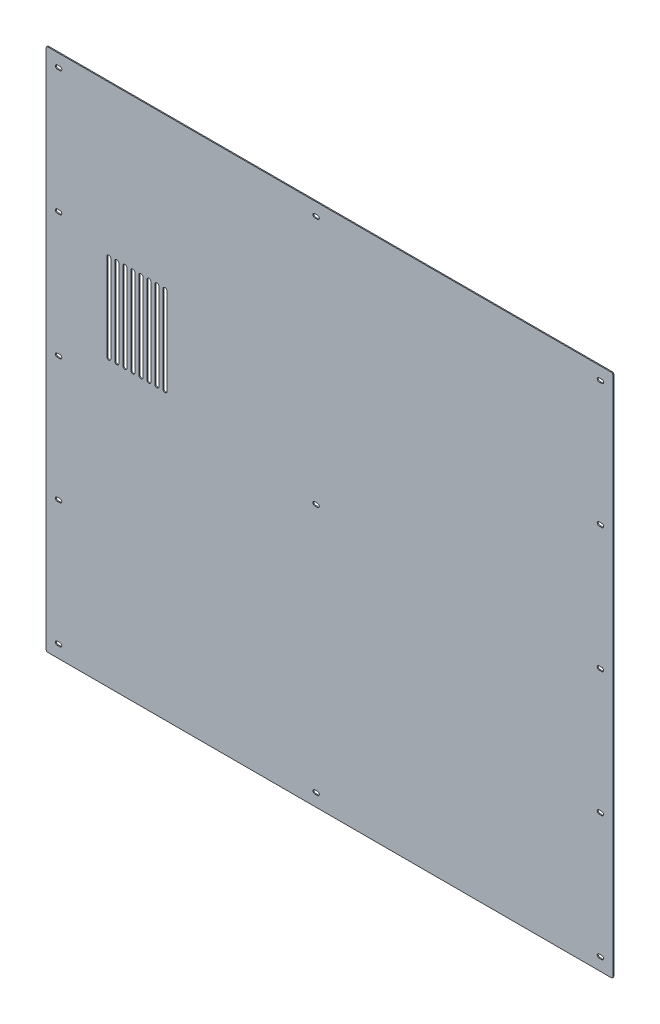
SolidWorks part; units mm, degrees
ref_plane "Ebene vorne" through (0, 0, 0) normal (0, 0, 1) x (1, 0, 0)
ref_plane "Ebene oben" through (0, 0, 0) normal (0, 1, 0) x (1, 0, 0)
ref_plane "Ebene rechts" through (0, 0, 0) normal (1, 0, 0) x (0, 0, -1)
sketch "Skizze1" plane through (0, 0, 0) normal (0, 0, 1) x (1, 0, 0)
  line L1 (-423.5, -392) -> (423.5, -392)
  line L2 (-423.5, -392) -> (-423.5, 392)
  line L3 (-423.5, 392) -> (423.5, 392)
  line L4 (423.5, -392) -> (423.5, 392)
  line L5 (-423.5, -392) -> (423.5, 392) construction
  line L6 (-423.5, 392) -> (423.5, -392) construction
  point P0 (0, 0)
  dimension "D1" = 847
  dimension "D2" = 784
base flange "Basis-Blech1" sketch "Skizze1" thickness 1.5 reverse thickness direction no parameters "D1"=8
hole_wizard "Durchgangsloch für M51" positions "Skizze7" profile "Skizze8" hole size "M5" standard "DIN"
sketch "Skizze7" plane through (0, 0, 0) normal (0, 0, 1) x (1, 0, 0)
  line L9 (-674.6731, 0) -> (0, 0) construction
  line L18 (0, 0) -> (0, 771.1759) construction
  line L20 (-405, -373) -> (-405, -186.5) construction
  line L21 (-405, -186.5) -> (-405, 0) construction
  line L22 (-405, 0) -> (-405, 186.5) construction
  line L23 (-405, 186.5) -> (-405, 373) construction
  line L26 (405, 373) -> (405, 186.5) construction
  line L27 (405, 186.5) -> (405, 0) construction
  line L28 (405, 0) -> (405, -186.5) construction
  line L29 (405, -186.5) -> (405, -373) construction
  line L33 (-423.5, 392) -> (-423.5, -392) construction
  line L34 (423.5, 392) -> (-423.5, 392) construction
  line L35 (423.5, -392) -> (423.5, 392) construction
  line L36 (0, 0) -> (0, -364.0549) construction
  line L37 (-20, 373) -> (-20, -373) construction
  point P108 (-405, -373)
  point P109 (-405, -186.5)
  point P111 (-405, 0)
  point P113 (-405, 186.5)
  point P115 (-405, 373)
  point P119 (405, 373)
  point P121 (405, 186.5)
  point P123 (405, 0)
  point P125 (405, -186.5)
  point P127 (405, -373)
  point P177 (-20, -373)
  point P178 (-20, 0)
  point P182 (-20, 373)
  dimension "D1" = 18.5
  dimension "D2" = 19
  dimension "D3" = 18.5
  dimension "D4" = 20
sketch "Skizze8" plane through (-20, 373, 0) normal (1, 0, 0) x (0, -1, 0)
  line L0 (0, 0) -> (0, 1.5)
  line L1 (0, 1.5) -> (2.75, 1.5)
  line L2 (2.75, 1.5) -> (2.75, 0)
  line L5 (2.75, 0) -> (0, 0)
  line L11 (0, -6.35) -> (0, 107.95) construction
  dimension "Bohrerdurchmesser" = 5.5
  dimension "Bohrungstiefe" = 1.5
break corner "Ecke brechen1" thickness 1.5 parameters "D1"=5, "D0"=5, "D7"=5
sketch "Skizze9" plane through (0, 0, 0) normal (0, 0, 1) x (1, 0, 0)
  line L0 (-407, 373) -> (-403, 373) construction
  line L1 (-407, 375.75) -> (-403, 375.75)
  line L2 (-407, 370.25) -> (-403, 370.25)
  line L3 (-407, 186.5) -> (-403, 186.5) construction
  line L4 (-407, 189.25) -> (-403, 189.25)
  line L5 (-407, 183.75) -> (-403, 183.75)
  line L6 (-407, 0) -> (-403, 0) construction
  line L7 (-407, 2.75) -> (-403, 2.75)
  line L8 (-407, -2.75) -> (-403, -2.75)
  line L9 (-407, -186.5) -> (-403, -186.5) construction
  line L10 (-407, -183.75) -> (-403, -183.75)
  line L11 (-407, -189.25) -> (-403, -189.25)
  line L12 (-407, -373) -> (-403, -373) construction
  line L13 (-407, -370.25) -> (-403, -370.25)
  line L14 (-407, -375.75) -> (-403, -375.75)
  line L15 (0, 0) -> (0, 493.5097) construction
  line L16 (407, 373) -> (403, 373) construction
  line L17 (407, 375.75) -> (403, 375.75)
  line L18 (407, 370.25) -> (403, 370.25)
  line L19 (407, 186.5) -> (403, 186.5) construction
  line L20 (407, 189.25) -> (403, 189.25)
  line L21 (407, 183.75) -> (403, 183.75)
  line L22 (407, 0) -> (403, 0) construction
  line L23 (407, 2.75) -> (403, 2.75)
  line L24 (407, -2.75) -> (403, -2.75)
  line L25 (407, -186.5) -> (403, -186.5) construction
  line L26 (407, -183.75) -> (403, -183.75)
  line L27 (407, -189.25) -> (403, -189.25)
  line L28 (407, -373) -> (403, -373) construction
  line L29 (407, -370.25) -> (403, -370.25)
  line L30 (407, -375.75) -> (403, -375.75)
  line L31 (-22, 373) -> (-18, 373) construction
  line L32 (-22, 375.75) -> (-18, 375.75)
  line L33 (-22, 370.25) -> (-18, 370.25)
  line L34 (-22, 0) -> (-18, 0) construction
  line L35 (-22, 2.75) -> (-18, 2.75)
  line L36 (-22, -2.75) -> (-18, -2.75)
  line L37 (-22, -373) -> (-18, -373) construction
  line L38 (-22, -370.25) -> (-18, -370.25)
  line L39 (-22, -375.75) -> (-18, -375.75)
  arc A0 (-407, 375.75) -> (-407, 370.25) centre (-407, 373) ccw
  arc A1 (-403, 370.25) -> (-403, 375.75) centre (-403, 373) ccw
  arc A2 (-407, 189.25) -> (-407, 183.75) centre (-407, 186.5) ccw
  arc A3 (-403, 183.75) -> (-403, 189.25) centre (-403, 186.5) ccw
  arc A4 (-407, 2.75) -> (-407, -2.75) centre (-407, 0) ccw
  arc A5 (-403, -2.75) -> (-403, 2.75) centre (-403, 0) ccw
  arc A6 (-407, -183.75) -> (-407, -189.25) centre (-407, -186.5) ccw
  arc A7 (-403, -189.25) -> (-403, -183.75) centre (-403, -186.5) ccw
  arc A8 (-407, -370.25) -> (-407, -375.75) centre (-407, -373) ccw
  arc A9 (-403, -375.75) -> (-403, -370.25) centre (-403, -373) ccw
  circle A10 centre (-405, -373) radius 2.75 construction
  arc A11 (407, 375.75) -> (407, 370.25) centre (407, 373) cw
  arc A12 (403, 370.25) -> (403, 375.75) centre (403, 373) cw
  arc A13 (407, 189.25) -> (407, 183.75) centre (407, 186.5) cw
  arc A14 (403, 183.75) -> (403, 189.25) centre (403, 186.5) cw
  arc A15 (407, 2.75) -> (407, -2.75) centre (407, 0) cw
  arc A16 (403, -2.75) -> (403, 2.75) centre (403, 0) cw
  arc A17 (407, -183.75) -> (407, -189.25) centre (407, -186.5) cw
  arc A18 (403, -189.25) -> (403, -183.75) centre (403, -186.5) cw
  arc A19 (407, -370.25) -> (407, -375.75) centre (407, -373) cw
  arc A20 (403, -375.75) -> (403, -370.25) centre (403, -373) cw
  arc A21 (-22, 375.75) -> (-22, 370.25) centre (-22, 373) ccw
  arc A22 (-18, 370.25) -> (-18, 375.75) centre (-18, 373) ccw
  arc A23 (-22, 2.75) -> (-22, -2.75) centre (-22, 0) ccw
  arc A24 (-18, -2.75) -> (-18, 2.75) centre (-18, 0) ccw
  arc A26 (-22, -370.25) -> (-22, -375.75) centre (-22, -373) ccw
  arc A28 (-18, -375.75) -> (-18, -370.25) centre (-18, -373) ccw
  point P2 (-405, 373)
  point P9 (-405, 186.5)
  point P17 (-405, 0)
  point P26 (-405, -186.5)
  point P34 (-405, -373)
  point P47 (405, 373)
  point P54 (405, 186.5)
  point P61 (405, 0)
  point P68 (405, -186.5)
  point P75 (405, -373)
  point P82 (-20, 373)
  point P88 (-20, 0)
  point P95 (-20, -373)
  dimension "D1" = 4
extrude "Schnitt-Linear austragen2" cut sketch "Skizze9" against normal through all
sketch "Skizze14" plane through (0, 0, 0) normal (0, 0, 1) x (1, 0, 0)
  line L0 (-330, 35) -> (-330, 165) construction
  line L1 (-333, 35) -> (-333, 165)
  line L2 (-327, 35) -> (-327, 165)
  arc A0 (-333, 35) -> (-327, 35) centre (-330, 35) ccw
  arc A1 (-327, 165) -> (-333, 165) centre (-330, 165) ccw
  point P2 (-330, 100)
  dimension "D1" = 6
  dimension "D2" = 130
  dimension "D3" = 100
  dimension "D4" = 330
extrude "Schnitt-Linear austragen5" cut sketch "Skizze14" against normal through all
pattern_linear "Lineares Muster1" count 8 spacing 12
sketch "Skizze15" [suppressed] plane through (0, 0, 0) normal (0, 0, 1) x (1, 0, 0)
  line L0 (-18, 375.75) -> (-22, 375.75) construction
  line L1 (-22, 370.25) -> (-18, 370.25) construction
  line L2 (-18, 375.75) -> (-22, 375.75)
  line L3 (-22, 370.25) -> (-18, 370.25)
  line L4 (-22, -2.75) -> (-18, -2.75) construction
  line L5 (-18, 2.75) -> (-22, 2.75) construction
  line L6 (-22, -2.75) -> (-18, -2.75)
  line L7 (-18, 2.75) -> (-22, 2.75)
  line L8 (-22, -375.75) -> (-18, -375.75) construction
  line L9 (-18, -370.25) -> (-22, -370.25) construction
  line L10 (-22, -375.75) -> (-18, -375.75)
  line L11 (-18, -370.25) -> (-22, -370.25)
  arc A0 (-22, 375.75) -> (-22, 370.25) centre (-22, 373) ccw construction
  arc A1 (-18, 370.25) -> (-18, 375.75) centre (-18, 373) ccw construction
  arc A2 (-22, 375.75) -> (-22, 370.25) centre (-22, 373) ccw
  arc A3 (-18, 370.25) -> (-18, 375.75) centre (-18, 373) ccw
  arc A4 (-18, -2.75) -> (-18, 2.75) centre (-18, 0) ccw construction
  arc A5 (-22, 2.75) -> (-22, -2.75) centre (-22, 0) ccw construction
  arc A6 (-18, -2.75) -> (-18, 2.75) centre (-18, 0) ccw
  arc A7 (-22, 2.75) -> (-22, -2.75) centre (-22, 0) ccw
  arc A8 (-18, -375.75) -> (-18, -370.25) centre (-18, -373) ccw construction
  arc A9 (-22, -370.25) -> (-22, -375.75) centre (-22, -373) ccw construction
  arc A10 (-18, -375.75) -> (-18, -370.25) centre (-18, -373) ccw
  arc A11 (-22, -370.25) -> (-22, -375.75) centre (-22, -373) ccw
extrude "Aufsatz-Linear austragen1" [suppressed] add sketch "Skizze15" against normal up to surface (1.5 mm away)
sketch "Biegung-Linien1" [suppressed] plane through (0, 0, 0) normal (0, 1, 0) x (1, 0, 0)
sketch "Rahmen1" [suppressed] plane through (0, 0, 0) normal (0, 1, 0) x (1, 0, 0)
sheet metal parameters "Blech7" thickness 1.5 parameters "D1"=8
flat pattern "Abwicklung7"
sketch "Biegung-Linien2" plane through (0, 0, 0) normal (0, 1, 0) x (1, 0, 0)
sketch3d "Rahmen2" [suppressed]
  line L0 (-322.5, 400, 0) -> (-322.5, -400, 0) construction
  line L1 (322.5, 400, 0) -> (322.5, -400, 0) construction
  line L2 (-322.5, 400, 0) -> (322.5, 400, 0) construction
  line L3 (-322.5, -400, 0) -> (322.5, -400, 0) construction
sheet metal parameters "Blech9" thickness 1.5 parameters "D1"=8
flat pattern "Abwicklung7"
sketch "Biegung-Linien2" plane through (0, 0, 0) normal (0, 1, 0) x (1, 0, 0)
sketch3d "Rahmen2" [suppressed]
  line L0 (322.4996, -400, 0) -> (322.5, 400, 0) construction
  line L1 (-322.5, -399.9996, 0) -> (-322.4996, 400.0004, 0) construction
  line L2 (322.4996, -400, 0) -> (-322.5, -399.9996, 0) construction
  line L3 (322.5, 400, 0) -> (-322.4996, 400.0004, 0) construction
sheet metal parameters "Blech10" thickness 1.5 parameters "D1"=8
flat pattern "Abwicklung7"
sketch "Biegung-Linien2" plane through (0, 0, 0) normal (0, 1, 0) x (1, 0, 0)
sketch3d "Rahmen2" [suppressed]
  line L0 (322.4996, -400, 0) -> (322.5, 400, 0) construction
  line L1 (-322.5, -399.9996, 0) -> (-322.4996, 400.0004, 0) construction
  line L2 (322.4996, -400, 0) -> (-322.5, -399.9996, 0) construction
  line L3 (322.5, 400, 0) -> (-322.4996, 400.0004, 0) construction
sheet metal parameters "Blech14" thickness 1.5 parameters "D1"=8
flat pattern "Abwicklung7"
sketch "Biegung-Linien2" plane through (0, 0, 0) normal (0, 1, 0) x (1, 0, 0)
sketch3d "Rahmen2" [suppressed]
  line L0 (322.4996, -400, 0) -> (322.5, 400, 0) construction
  line L1 (-322.5, -399.9996, 0) -> (-322.4996, 400.0004, 0) construction
  line L2 (322.4996, -400, 0) -> (-322.5, -399.9996, 0) construction
  line L3 (322.5, 400, 0) -> (-322.4996, 400.0004, 0) construction
sheet metal parameters "Blech15" thickness 1.5 parameters "D1"=8
flat pattern "Abwicklung7"
sketch "Biegung-Linien2" plane through (0, 0, 0) normal (0, 1, 0) x (1, 0, 0)
sketch3d "Rahmen2" [suppressed]
  line L0 (-423.4996, 392.0005, 0) -> (423.5, 392, 0) construction
  line L1 (-423.5, -391.9995, 0) -> (423.4996, -392, 0) construction
  line L2 (-423.4996, 392.0005, 0) -> (-423.5, -391.9995, 0) construction
  line L3 (423.5, 392, 0) -> (423.4996, -392, 0) construction
sheet metal parameters "Blech16" [suppressed] thickness 1.5 parameters "D1"=8
flat pattern "Abwicklung7"
sketch "Biegung-Linien2" plane through (0, 0, 0) normal (0, 1, 0) x (1, 0, 0)
sketch3d "Rahmen2" [suppressed]
  line L0 (323.4996, -392, 0) -> (323.5, 392, 0) construction
  line L1 (-323.5, -391.9996, 0) -> (-323.4996, 392.0004, 0) construction
  line L2 (323.4996, -392, 0) -> (-323.5, -391.9996, 0) construction
  line L3 (323.5, 392, 0) -> (-323.4996, 392.0004, 0) construction
